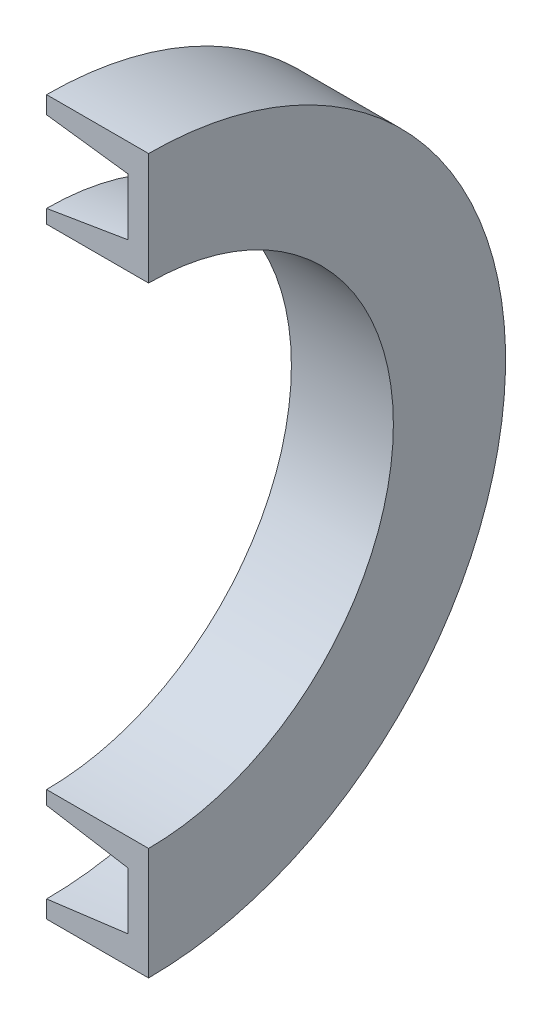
SolidWorks part; units mm, degrees
ref_plane "Plan1" through (0, 0, 0) normal (0, 0, 1) x (1, 0, 0)
ref_plane "Plan2" through (0, 0, 0) normal (0, 1, 0) x (1, 0, 0)
ref_plane "Plan3" through (0, 0, 0) normal (1, 0, 0) x (0, 0, -1)
sketch "Esquisse1" plane through (0, 0, 0) normal (0, 0, 1) x (1, 0, 0)
  line L0 (-20, 12.6718) -> (-16, 13.3344)
  line L1 (-15, 17.5) -> (-20, 17.5)
  line L2 (-15, 17.5) -> (-15, 12)
  line L3 (-15, 12) -> (-20, 12)
  line L4 (-20, 17.5) -> (-20, 16.6442)
  line L5 (-20, 16.6442) -> (-16, 16.1288)
  line L6 (-20, 12.6718) -> (-20, 12)
  line L7 (0, 0) -> (-30, 0) construction
  line L8 (-16, 16.1288) -> (-16, 13.3344)
  dimension "D1" = 12
  dimension "D2" = 17.5
  dimension "D3" = 5
revolve "Base-Révolution" add sketch "Esquisse1" angle 360 about L7
sketch "Esquisse2" plane through (-15, 0, 0) normal (1, 0, 0) x (0, 0, -1)
  line L1 (0, 20) -> (-20, 20)
  line L2 (0, 20) -> (0, -20)
  line L3 (0, -20) -> (-20, -20)
  line L4 (-20, 20) -> (-20, -20)
extrude "Enlèv. mat.-Extru.1" cut sketch "Esquisse2" against normal through all
